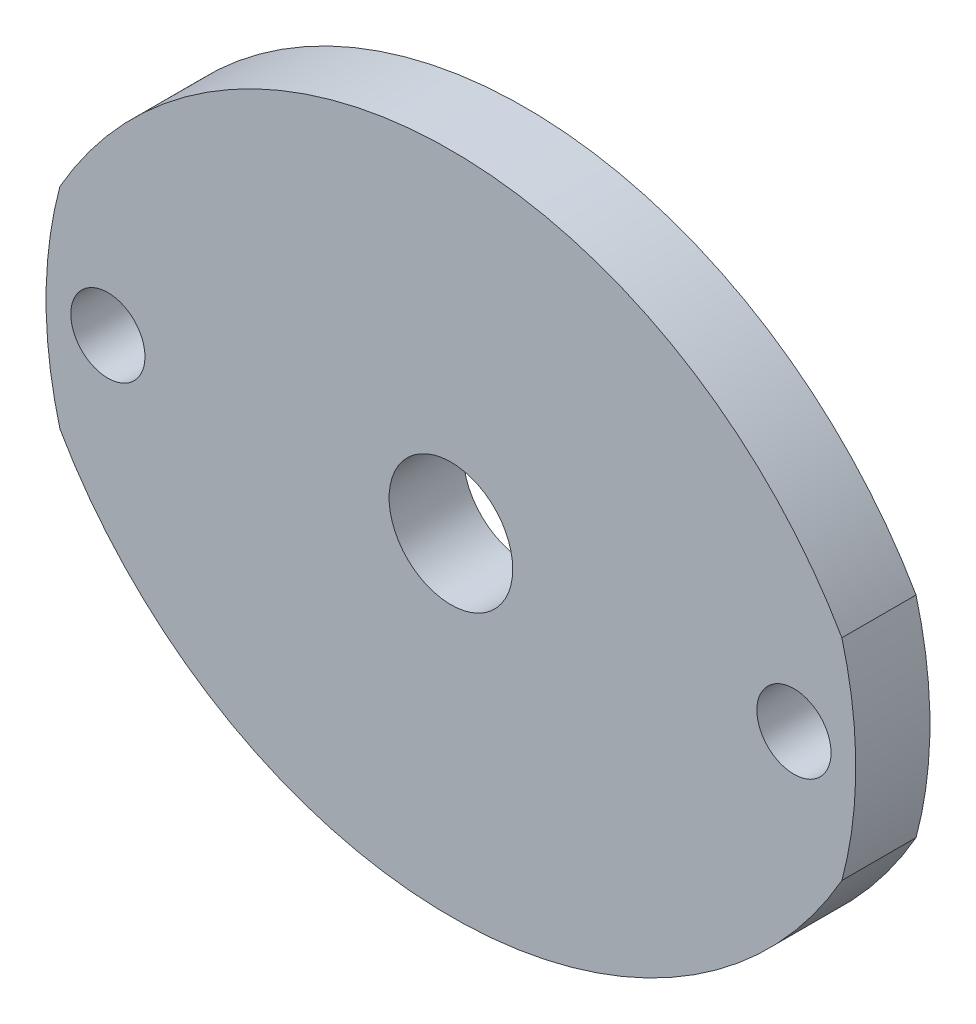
SolidWorks part; units mm, degrees
ref_plane "Front Plane" through (0, 0, 0) normal (0, 0, 1) x (1, 0, 0)
ref_plane "Top Plane" through (0, 0, 0) normal (0, 1, 0) x (1, 0, 0)
ref_plane "Right Plane" through (0, 0, 0) normal (1, 0, 0) x (0, 0, -1)
sketch "Sketch1" plane through (0, 0, 0) normal (0, 0, 1) x (1, 0, 0)
  circle A3 centre (18.2002, -0.2259) radius 2.5
  circle A11 centre (32.0752, -0.2259) radius 1.5
  circle A12 centre (4.3252, -0.2259) radius 1.5
  arc A19 (2.3864, 4.0242) -> (2.3864, -4.4761) centre (18.2002, -0.2259) ccw
  arc A20 (34.014, -4.4761) -> (34.014, 4.0242) centre (18.2002, -0.2259) ccw
  arc A21 (34.014, 4.0242) -> (2.3864, 4.0242) centre (18.2002, -5.0167) ccw
  arc A22 (2.3864, -4.4761) -> (34.014, -4.4761) centre (18.2002, 4.5649) ccw
extrude "Boss-Extrude1" add sketch "Sketch1" along normal blind 3
